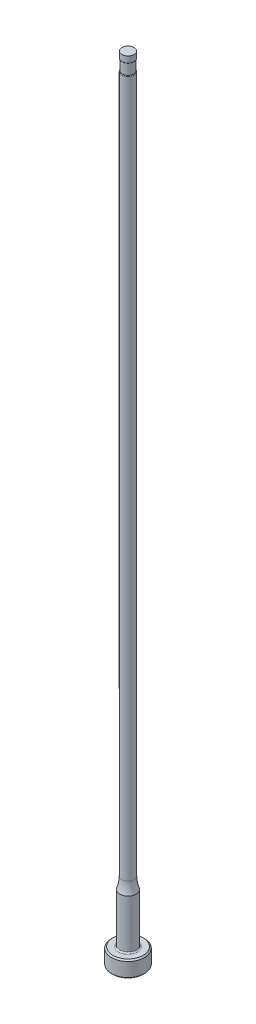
SolidWorks part; units mm, degrees
ref_plane "Front Plane" through (0, 0, 0) normal (0, 0, 1) x (1, 0, 0)
ref_plane "Top Plane" through (0, 0, 0) normal (0, 1, 0) x (1, 0, 0)
ref_plane "Right Plane" through (0, 0, 0) normal (1, 0, 0) x (0, 0, -1)
other "Configuration Table"
sketch "Sketch1" plane through (0, 0, 0) normal (0, 0, 1) x (1, 0, 0)
  line L0 (0, 259.9588) -> (0, -15.1925) construction
  line L1 (0, 0) -> (-3.175, 0)
  line L2 (-3.175, 0) -> (-3.175, 3.175)
  line L3 (-3.175, 3.175) -> (-1.5875, 3.175)
  line L4 (-1.19, 14.9114) -> (-1.19, 152.4)
  line L5 (-1.19, 152.4) -> (0, 152.4)
  line L6 (0, 152.4) -> (0, 0)
  line L7 (-1.5875, 3.175) -> (-1.5875, 12.7)
  arc A1 (-1.5875, 12.7) -> (-1.19, 14.9114) centre (-7.54, 14.9114) ccw
  dimension "D1" = 6.35
  dimension "L" = 152.4
  dimension "D2" = 3.175
  dimension "H" = 6.35
  dimension "T" = 3.175
  dimension "D" = 2.38
  dimension "S" = 12.7
revolve "Revolve1" add sketch "Sketch1" angle 360 about L0
chamfer "Chamfer1" distance 0.254 angle 45 2 edges at (0, 3.175, 3.175) (0, 0, 3.175)
fillet "Fillet1" radius 0.254 1 edges at (0, 3.175, 1.5875)
sketch "Sketch2" plane through (0, 0, 0) normal (0, 0, 1) x (1, 0, 0)
  line L0 (-1.19, 152.4) -> (-1.19, 14.9114) construction
  line L1 (-1.19, 151.13) -> (-1.0884, 151.13)
  line L2 (-1.19, 151.13) -> (-1.19, 149.098)
  line L3 (-1.19, 149.098) -> (-1.0884, 149.098)
  line L4 (-1.0884, 151.13) -> (-1.0884, 149.098)
  line L5 (1.19, 152.4) -> (-1.19, 152.4) construction
  line L6 (0, 153.4483) -> (0, 147.3282) construction
  dimension "D1" = 2.032
  dimension "N" = 1.27
  dimension "FD" = 0.1016
  dimension "D3" = 2.1768
revolve "Vent Relief" cut sketch "Sketch2" angle 360 about L6
sketch "Sketch3" plane through (0, 0, 0) normal (0, 0, 1) x (1, 0, 0)
  line L0 (-1.0884, 150.114) -> (-1.0884, 112.014)
  line L1 (-1.0884, 151.13) -> (-1.0884, 149.098) construction
  line L2 (-1.19, 149.098) -> (-1.19, 14.9114) construction
  line L3 (-1.19, 111.2172) -> (-1.19, 150.114)
  line L4 (-1.19, 150.114) -> (-1.0884, 150.114)
  arc A0 (-1.0884, 112.014) -> (-1.19, 111.2172) centre (-4.2634, 112.014) cw
  dimension "D1" = 3.175
  dimension "D2" = 38.1
extrude "D-Slot" cut sketch "Sketch3" against normal through all both and the other way through all
sketch "Sketch5" plane through (0, 0, 0) normal (0, 0, 1) x (1, 0, 0)
  line L0 (-1.19, 151.13) -> (1.19, 151.13) construction
  line L1 (-1.19, 152.4) -> (-1.1773, 152.4)
  line L2 (-1.19, 152.4) -> (-1.19, 151.13)
  line L3 (-1.19, 151.13) -> (-1.1773, 151.13)
  line L4 (-1.1773, 152.4) -> (-1.1773, 151.13)
  line L5 (0, 152.6877) -> (0, 150.5771) construction
  dimension "VP" = 0.0127
revolve "Vent Diameter" cut sketch "Sketch5" angle 360 about L5
fillet "Fillet2" radius 0.127 2 edges at (1.19, 149.098, 0) (0, 151.13, 1.1773)
sketch "Pocket Sketch" plane through (0, 0, 0) normal (0, 0, 1) x (1, 0, 0)
  line L0 (-3.5719, 0) -> (-3.5719, 3.2004)
  line L1 (-3.5719, 3.2004) -> (-2.1504, 3.2004)
  line L2 (-1.3884, 3.9624) -> (-1.3884, 22.225)
  line L3 (-1.3884, 22.225) -> (0, 22.225)
  line L4 (0, 22.225) -> (0, 0)
  line L5 (0, 0) -> (-3.5719, 0)
  line L6 (0, 12.6104) -> (0, -2.4989) construction
  line L7 (-3.175, 2.921) -> (-3.175, 0.254) construction
  line L8 (2.921, 3.175) -> (-2.921, 3.175) construction
  line L9 (-1.19, 111.2172) -> (-1.19, 14.9114) construction
  line L10 (-2.1504, 3.2004) -> (-1.3884, 3.9624)
  point P3 (-1.3884, 3.2004)
  dimension "D1" = 7.1437
  dimension "D2" = 0.3969
  dimension "D3" = 0.0254
  dimension "D4" = 0.1984
  dimension "D5" = 2.7769
  dimension "D6" = 22.225
